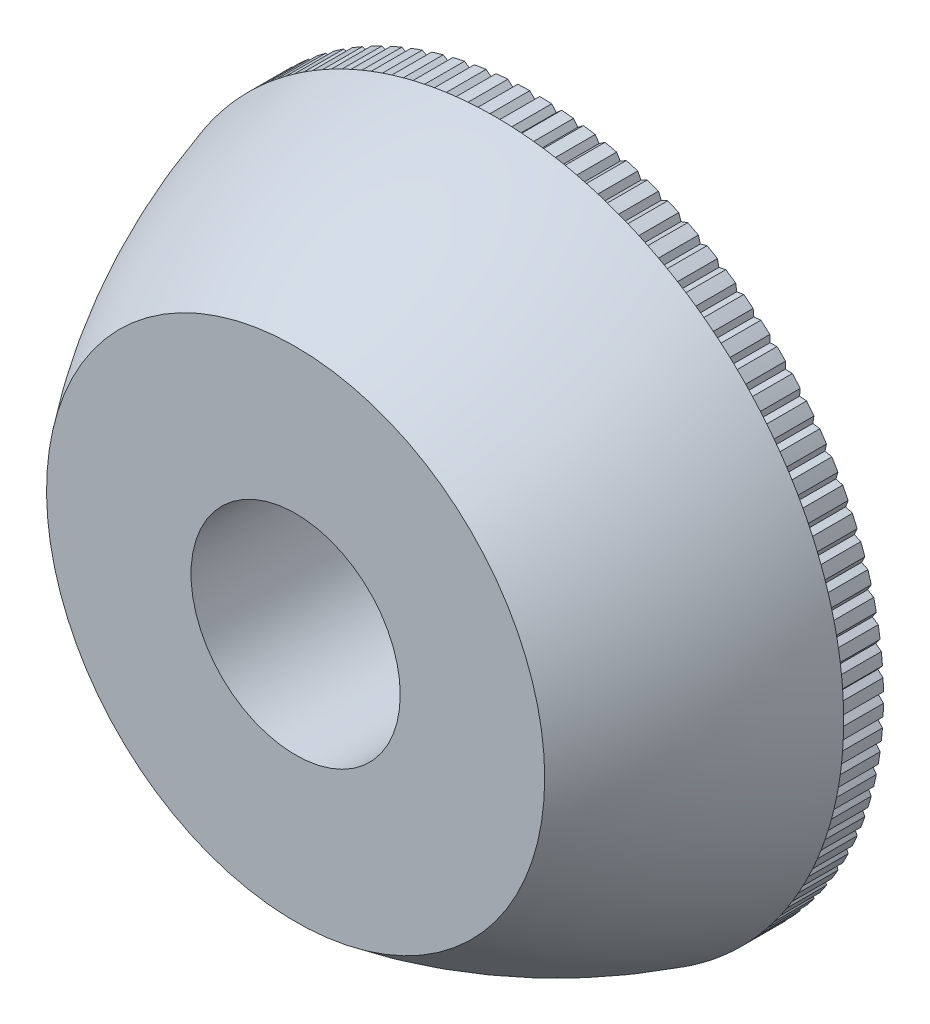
SolidWorks part; units mm, degrees
ref_plane "Front Plane" through (0, 0, 0) normal (0, 0, 1) x (1, 0, 0)
ref_plane "Top Plane" through (0, 0, 0) normal (0, 1, 0) x (1, 0, 0)
ref_plane "Right Plane" through (0, 0, 0) normal (1, 0, 0) x (0, 0, -1)
sketch "Sketch1" plane through (0, 0, 0) normal (0, 1, 0) x (1, 0, 0)
  line L0 (0, 0) -> (12.5, 0)
  line L1 (17.5, 10) -> (17.5, 12)
  line L2 (17.5, 12) -> (0, 12)
  line L3 (0, 12) -> (0, 0)
  line L4 (0, 0) -> (0, 54.2021) construction
  arc A0 (12.5, 0) -> (17.5, 10) centre (-11.3629, 18.1814) ccw
  dimension "D1" = 30
  dimension "D2" = 35
  dimension "D3" = 25
  dimension "D4" = 12
  dimension "D5" = 2
revolve "Revolve1" add sketch "Sketch1" angle 360 about L4
hole_wizard "M12x1.5 Tapped Hole1" positions "Sketch3" profile "Sketch2" tap size "M12x1.5" standard "ISO"
sketch "Sketch3" plane through (0, 0, 0) normal (0, 0, 1) x (1, 0, 0)
  point P0 (0, 0)
sketch "Sketch2" plane through (0, 0, 0) normal (1, 0, 0) x (0, -1, 0)
  line L0 (0, 0) -> (0, 12)
  line L1 (0, 12) -> (5.25, 12)
  line L2 (5.25, 12) -> (5.25, 0)
  line L5 (5.25, 0) -> (0, 0)
  line L11 (0, -6.35) -> (0, 107.95) construction
  dimension "Thru Tap Drill Dia." = 10.5
  dimension "Thru Tap Drill Depth" = 12
sketch "Sketch4" plane through (0, 0, -12) normal (0, 0, -1) x (-1, 0, 0)
  line L0 (0, 0) -> (0, 21.8267) construction
  line L1 (0, 17.2482) -> (-0.25, 17.4982)
  line L2 (0, 17.2482) -> (0.25, 17.4982)
  line L3 (0, 0) -> (1.0988, 17.4655) construction
  circle A0 centre (0, 0) radius 17.5 construction
  arc A1 (0.25, 17.4982) -> (-0.25, 17.4982) centre (0, 0) ccw
  dimension "D1" = 0.5
  dimension "D2" = 90
  dimension "D3" = 3.6
extrude "Cut-Extrude1" cut sketch "Sketch4" against normal blind 2
pattern_circular "CirPattern1" count 100 over 360 about axis through (0, 0, 0) along (0, 0, 1) of "Cut-Extrude1"
